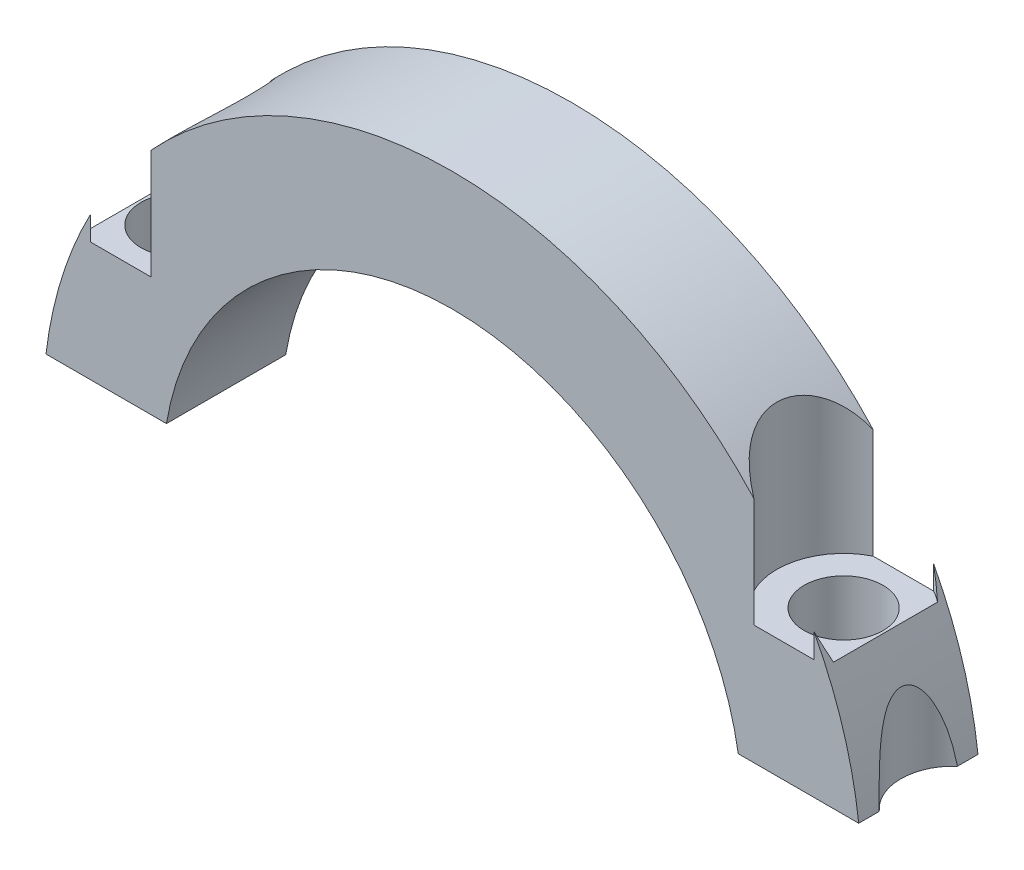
SolidWorks part; units mm, degrees
ref_plane "Front Plane" through (0, 0, 0) normal (0, 0, 1) x (1, 0, 0)
ref_plane "Top Plane" through (0, 0, 0) normal (0, 1, 0) x (1, 0, 0)
ref_plane "Right Plane" through (0, 0, 0) normal (1, 0, 0) x (0, 0, -1)
sketch "Sketch1" plane through (0, 0, 0) normal (0, 0, 1) x (1, 0, 0)
  line L0 (55, 0) -> (-55, 0) construction
  line L1 (-11.9843, 2) -> (-11.9843, 0) construction
  line L2 (11.9843, 2) -> (11.9843, 0) construction
  line L3 (-11.9843, 2) -> (-17.033, 2)
  line L4 (11.9843, 2) -> (17.033, 2)
  circle A0 centre (0, 0) radius 12.15 construction
  arc A1 (-11.9843, 2) -> (11.9843, 2) centre (0, 0) cw
  circle A2 centre (0, 0) radius 17.15 construction
  arc A3 (-17.033, 2) -> (17.033, 2) centre (0, 0) cw
  dimension "D1" = 24.3
  dimension "D2" = 5
  dimension "D3" = 2
extrude "Boss-Extrude1" add sketch "Sketch1" along normal mid plane 5
sketch "Sketch2" plane through (0, 2, 0) normal (0, -1, 0) x (1, 0, 0)
  line L0 (8.3325, 0) -> (-8.3325, 0) construction
  line L1 (0, -2.75) -> (0, 2.75) construction
  circle A0 centre (-13.9, 0) radius 1.65
  circle A1 centre (-18.5, 0) radius 2.2
  point P8 (0, 0)
  dimension "D1" = 3.3
  dimension "D4" = 4.4
  dimension "D2" = 13.9
  dimension "D3" = 18.5
extrude "Cut-Extrude1" cut sketch "Sketch2" against normal through all both
ref_plane "Plane1" through (0, 7, 0) normal (0, 1, 0) x (1, 0, 0)
sketch "Sketch3" plane through (0, 7, 0) normal (0, 1, 0) x (1, 0, 0)
  circle A0 centre (-13.9, 0) radius 2.8
  dimension "D1" = 5.6
extrude "Cut-Extrude2" cut sketch "Sketch3" along normal through all
mirror "Mirror1" about plane through (0, 0, 0) normal (1, 0, 0) of "Cut-Extrude2", "Cut-Extrude1"
